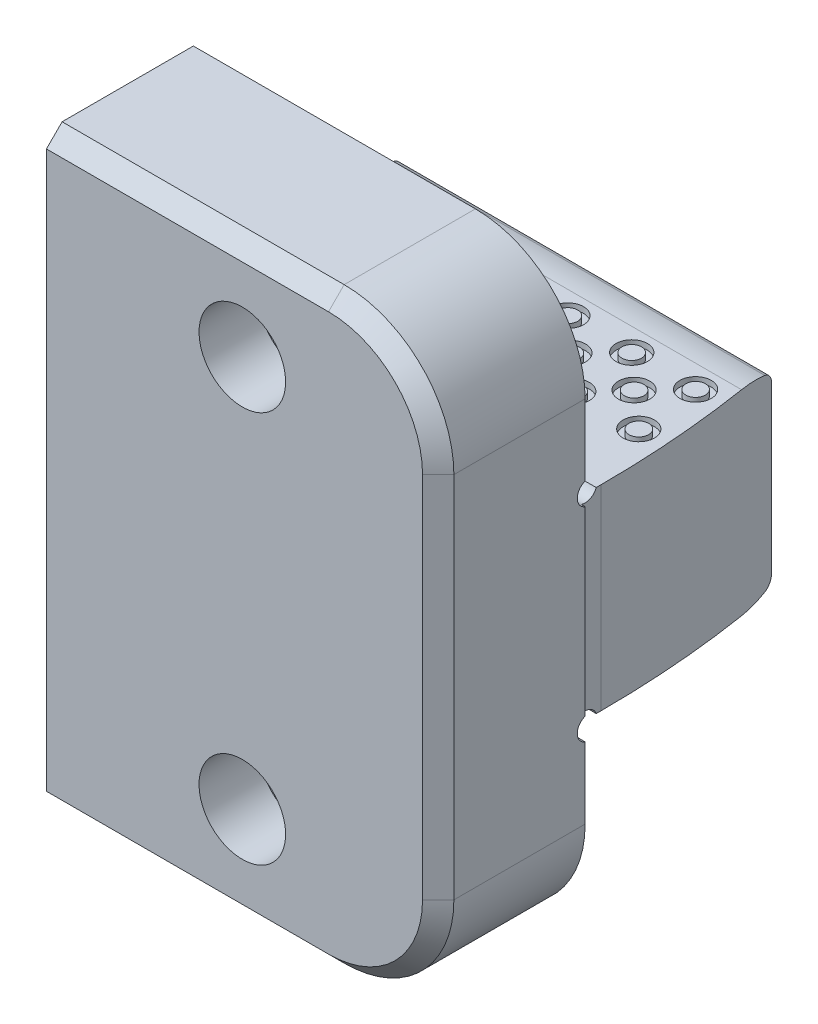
SolidWorks part; units mm, degrees
ref_plane "Front Plane" through (0, 0, 0) normal (0, 0, 1) x (1, 0, 0)
ref_plane "Top Plane" through (0, 0, 0) normal (0, 1, 0) x (1, 0, 0)
ref_plane "Right Plane" through (0, 0, 0) normal (1, 0, 0) x (0, 0, -1)
sketch "Sketch3" plane through (0, 0, 0) normal (1, 0, 0) x (0, 0, -1)
  line L0 (0, 13.97) -> (0, -13.97) construction
  line L1 (-9.525, -19.05) -> (0, -19.05)
  line L2 (-9.525, -19.05) -> (-9.525, 19.05)
  line L3 (-9.525, 19.05) -> (0, 19.05)
  line L4 (13.5382, -6.3475) -> (13.5382, 6.3475)
  line L6 (0, -19.05) -> (0, -6.3475)
  line L7 (0, -6.3475) -> (13.5382, -6.3475)
  line L8 (0, 19.05) -> (0, 6.3475)
  line L9 (0, 6.3475) -> (13.5382, 6.3475)
  line L10 (0, 0) -> (50000, 0) construction
  dimension "D1" = 23.0632
  dimension "D2" = 9.525
  dimension "D3" = 38.1
  dimension "D4" = 12.6949
extrude "Extrude1" add sketch "Sketch3" along normal mid plane 25.4
sketch "Sketch7" plane through (12.7, 0, 0) normal (1, 0, 0) x (0, 0, -1)
  line L1 (0, -14.5526) -> (21.9683, -14.5526)
  line L2 (0, -14.5526) -> (0, 17.1683)
  line L3 (0, 17.1683) -> (21.9683, 17.1683)
  line L4 (21.9683, -14.5526) -> (21.9683, 17.1683)
  line L5 (0, -19.05) -> (0, -6.3475) construction
extrude "Cut-Extrude3" cut sketch "Sketch7" against normal blind 0.254
sketch "Sketch8" plane through (12.7, 0, 0) normal (1, 0, 0) x (0, 0, -1)
  line L0 (0, 0) -> (50000, 0) construction
  line L1 (0, -19.05) -> (0, 19.05) construction
  line L2 (0, 6.3475) -> (13.5382, 6.3475) construction
  circle A0 centre (0.254, 6.6015) radius 0.762
  circle A1 centre (0.254, -6.6015) radius 0.762
  dimension "D1" = 0.762
  dimension "D2" = 0.508
  dimension "D3" = 0.508
extrude "Cut-Extrude4" cut sketch "Sketch8" against normal through all
sketch "Sketch9" plane through (12.7, 0, 0) normal (1, 0, 0) x (0, 0, -1)
  line L0 (0.9724, 6.3475) -> (13.5382, 6.3475) construction
  line L1 (13.5382, 6.3475) -> (13.5382, -6.3475) construction
  line L2 (0, 0) -> (50000, 0) construction
  line L3 (13.5382, 5.3514) -> (17.526, 5.3514)
  line L4 (11.176, 6.3475) -> (11.176, 11.7014)
  line L5 (11.176, 11.7014) -> (17.526, 11.7014)
  line L6 (17.526, 5.3514) -> (17.526, 11.7014)
  line L7 (17.526, -5.3514) -> (17.526, -11.7014)
  line L8 (11.176, -11.7014) -> (17.526, -11.7014)
  line L9 (11.176, -6.3475) -> (11.176, -11.7014)
  line L10 (13.5382, -5.3514) -> (17.526, -5.3514)
  arc A0 (11.176, 6.3475) -> (12.9944, 6.0815) centre (11.176, -0.0025) cw
  arc A1 (12.9944, 6.0815) -> (13.5382, 5.3514) centre (12.7762, 5.3514) cw
  arc A2 (12.9944, -6.0815) -> (13.5382, -5.3514) centre (12.7762, -5.3514) ccw
  arc A3 (11.176, -6.3475) -> (12.9944, -6.0815) centre (11.176, 0.0025) ccw
  dimension "D1" = 0.762
  dimension "D2" = 6.35
  dimension "D3" = 2.3622
  dimension "D4" = 6.35
  dimension "D5" = 6.35
extrude "Cut-Extrude5" cut sketch "Sketch9" against normal through all
sketch "Sketch13" plane through (0, 19.05, 0) normal (0, 1, 0) x (1, 0, 0)
  line L0 (12.446, 0.9724) -> (12.446, 11.176) construction
  line L2 (11.163, 13.97) -> (23.863, 13.97)
  line L4 (12.446, 1.27) -> (23.863, 1.27)
  line L5 (23.863, 13.97) -> (23.863, 1.27)
  arc A0 (11.163, 13.97) -> (12.446, 1.27) centre (-51.054, 1.27) cw
  dimension "D1" = 63.5
  dimension "D2" = 1.27
  dimension "D3" = 12.7
  dimension "D4" = 12.7
extrude "Cut-Extrude6" cut sketch "Sketch13" against normal through all
sketch "Sketch15" plane through (0, 6.3475, 0) normal (0, 1, 0) x (1, 0, 0)
  line L0 (12.7, -9.525) -> (-12.7, -9.525) construction
  line L1 (-12.7, 11.176) -> (-12.7, 0.9724) construction
  circle A0 centre (-6.4008, 9.7028) radius 1.016
  circle A1 centre (-6.4008, 9.7028) radius 0.635
  circle A2 centre (-2.2606, 9.7028) radius 1.016
  circle A3 centre (-2.2606, 9.7028) radius 0.635
  circle A4 centre (-10.541, 9.7028) radius 1.016
  circle A5 centre (-10.541, 9.7028) radius 0.635
  circle A6 centre (1.8796, 9.7028) radius 1.016
  circle A7 centre (1.8796, 9.7028) radius 0.635
  circle A8 centre (6.0198, 9.7028) radius 1.016
  circle A9 centre (6.0198, 9.7028) radius 0.635
  circle A10 centre (10.16, 9.7028) radius 1.016
  circle A11 centre (10.16, 9.7028) radius 0.635
  circle A12 centre (-4.2926, 7.6708) radius 1.016
  circle A13 centre (-4.2926, 7.6708) radius 0.635
  circle A14 centre (-0.127, 7.6708) radius 1.016
  circle A15 centre (-0.127, 7.6708) radius 0.635
  circle A16 centre (-8.4582, 7.6708) radius 1.016
  circle A17 centre (-8.4582, 7.6708) radius 0.635
  circle A18 centre (4.0386, 7.6708) radius 1.016
  circle A19 centre (4.0386, 7.6708) radius 0.635
  circle A20 centre (8.2042, 7.6708) radius 1.016
  circle A21 centre (8.2042, 7.6708) radius 0.635
  circle A24 centre (-6.3246, 5.6388) radius 1.016
  circle A25 centre (-6.3246, 5.6388) radius 0.635
  circle A26 centre (-2.1082, 5.6388) radius 1.016
  circle A27 centre (-2.1082, 5.6388) radius 0.635
  circle A28 centre (-10.541, 5.6388) radius 1.016
  circle A29 centre (-10.541, 5.6388) radius 0.635
  circle A30 centre (2.1082, 5.6388) radius 1.016
  circle A31 centre (2.1082, 5.6388) radius 0.635
  circle A32 centre (6.3246, 5.6388) radius 1.016
  circle A33 centre (6.3246, 5.6388) radius 0.635
  circle A34 centre (10.541, 5.6388) radius 1.016
  circle A35 centre (10.541, 5.6388) radius 0.635
  dimension "D1" = 19.2278
  dimension "D2" = 2.032
  dimension "D12" = 4.2164
  dimension "D7" = 2.032
  dimension "D8" = 1.27
  dimension "D3" = 2.032
  dimension "D4" = 2.159
  dimension "D5" = 4.2418
  dimension "D6" = 4.2164
  dimension "D9" = 4.2164
  dimension "D10" = 4.2164
  dimension "D11" = 4.2164
  dimension "D13" = 4.1656
  dimension "D14" = 4.1656
  dimension "D15" = 4.1656
  dimension "D16" = 4.1656
  dimension "D17" = 4.1402
  dimension "D18" = 4.1402
  dimension "D19" = 4.1402
  dimension "D20" = 4.1402
  dimension "D21" = 4.1402
extrude "Cut-Extrude7" cut sketch "Sketch15" against normal blind 0.381
mirror "Mirror1" about plane through (0, 0, 0) normal (0, 1, 0) of "Cut-Extrude7"
hole_wizard "#10 CBORE" positions "Sketch11" profile "Sketch10" counterbore size "#10" standard "Ansi Inch"
sketch "Sketch11" plane through (0, 0, 0) normal (0, 0, -1) x (-1, 0, 0)
  line L0 (0, 0) -> (0, 50000) construction
  line L1 (0, 0) -> (50000, 0) construction
  point P0 (0, 12.7)
  point P10 (0, -12.7)
  dimension "D1" = 25.4
sketch "Sketch10" plane through (0, 12.7, 0) normal (1, 0, 0) x (0, 1, 0)
  line L0 (0, 0) -> (0, 9.525)
  line L1 (0, 9.525) -> (2.8067, 9.525)
  line L3 (2.8067, 9.525) -> (2.8067, 5.6197)
  line L4 (2.8067, 5.6197) -> (4.7625, 5.6197)
  line L5 (4.7625, 5.6197) -> (4.7625, 0)
  line L7 (4.7625, 0) -> (0, 0)
  line L11 (0, -6.35) -> (0, 107.95) construction
  dimension "Thru Hole Dia." = 5.6134
  dimension "Thru Hole Depth" = 9.525
  dimension "C'Bore Dia." = 9.525
  dimension "C'Bore Depth" = 5.6197
fillet "Fillet1" radius 7.112 2 edges at (12.7, 19.05, 4.7625) (12.7, -19.05, 4.7625)
chamfer "Chamfer1" distance 1.016 angle 45 5 edges at (-3.556, 19.05, 9.525) (-3.556, -19.05, 9.525) (12.7, 0, 9.525) (10.6169, 16.9669, 9.525) (10.6169, -16.9669, 9.525)
